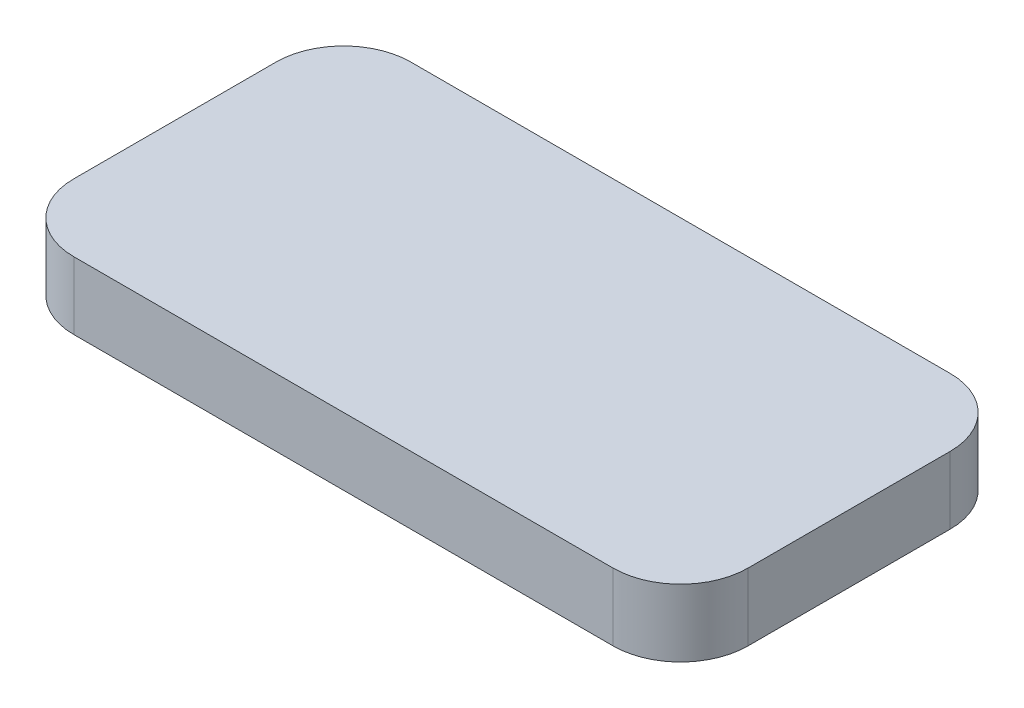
SolidWorks part; units mm, degrees
ref_plane "Front Plane" through (0, 0, 0) normal (0, 0, 1) x (1, 0, 0)
ref_plane "Top Plane" through (0, 0, 0) normal (0, 1, 0) x (1, 0, 0)
ref_plane "Right Plane" through (0, 0, 0) normal (1, 0, 0) x (0, 0, -1)
sketch "Sketch1" plane through (0, 0, 0) normal (0, 1, 0) x (1, 0, 0)
  line L1 (20, 0) -> (180, 0)
  line L2 (0, 20) -> (0, 80)
  line L3 (20, 100) -> (180, 100)
  line L4 (200, 20) -> (200, 80)
  arc A0 (0, 80) -> (20, 100) centre (20, 80) cw
  arc A1 (0, 20) -> (20, 0) centre (20, 20) ccw
  arc A2 (180, 0) -> (200, 20) centre (180, 20) ccw
  arc A3 (180, 100) -> (200, 80) centre (180, 80) cw
  point P7 (0, 100)
  point P11 (0, 0)
  point P14 (200, 0)
  dimension "D3" = 20
  dimension "D1" = 200
  dimension "D2" = 100
extrude "Extrude1" add sketch "Sketch1" along normal blind 20
